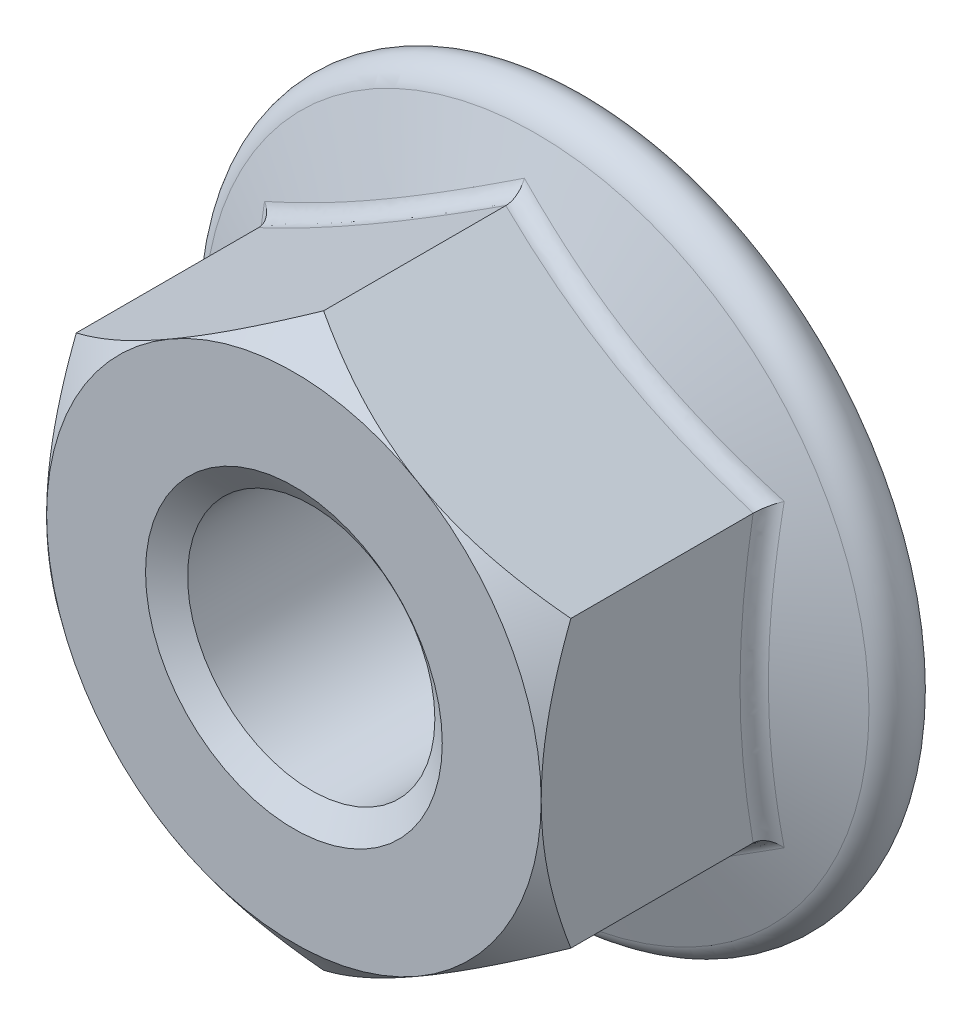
SolidWorks part; units mm, degrees
ref_plane "Plane1" through (0, 0, 0) normal (0, 0, 1) x (1, 0, 0)
ref_plane "Plane2" through (0, 0, 0) normal (0, 1, 0) x (1, 0, 0)
ref_plane "Plane3" through (0, 0, 0) normal (1, 0, 0) x (0, 0, -1)
revolve "EndChamfer" cut sketch "Sketch5"
sketch "Sketch5"
  line L0 (5.9746, 3) -> (5.5895, 2.45)
  line L1 (6.0254, 3) -> (5.9746, 3)
  line L2 (6.0254, 3) -> (6.0254, 2.45)
  line L3 (6.0254, 2.45) -> (5.5895, 2.45)
  line L6 (-0.0508, 3) -> (0, 3)
  line L7 (0, 3) -> (0.3851, 2.45)
  line L9 (0.3851, 2.45) -> (-0.0508, 2.45)
  line L10 (-0.0508, 2.45) -> (-0.0508, 3)
  line L11 (25.0375, 0) -> (38.388, 0) construction
  line L12 (6, 0) -> (0, 0) construction
extrude "BaseNut" add sketch "BaseNutSke" against normal blind 6
sketch "BaseNutSke" plane through (0, 0, 0) normal (0, 0, 1) x (1, 0, 0)
  line L6 (5, 2.8868) -> (5, -2.8868)
  line L7 (-5, 2.8868) -> (-5, -2.8868)
  line L8 (5, 2.8868) -> (0, 5.7735)
  line L9 (0, 5.7735) -> (-5, 2.8868)
  line L10 (-5, -2.8868) -> (0, -5.7735)
  line L11 (0, -5.7735) -> (5, -2.8868)
  circle A0 centre (0, 0) radius 2.5
  dimension "D4" = 5
  dimension "Tap_drill" = 5
  dimension "D1" = 120
  dimension "D2" = 5
  dimension "D3" = 5
  dimension "Width_flats" = 10
pattern_linear "ThdSchPat"
revolve "ThreadSchematic" cut sketch "ThdSchSke" angle 360 about L11
sketch "ThdSchSke" plane through (0, 0, 0) normal (0, 1, 0) x (1, 0, 0)
  line L0 (-3, 0.0254) -> (-2.5, 0.3755)
  line L1 (-2.5, 0.3755) -> (-1.25, 0.3755)
  line L2 (-1.25, 0.3755) -> (-1.25, -0.3247)
  line L3 (-1.25, -0.3247) -> (-2.5, -0.3247)
  line L4 (-2.5, -0.3247) -> (-3, 0.0254)
  line L5 (-3.175, 1) -> (3.175, 1) construction
  line L6 (0, 1) -> (0, -2.9874) construction
  line L7 (0, 5.6245) -> (0, 0.3501) construction
  dimension "D1" = 35
  dimension "VeeAngle" = 70
  dimension "SideAngle" = 55
  dimension "D2" = 0.0508
  dimension "OverCut" = 2.5
  dimension "Tap_Drill" = 5
  dimension "Advance" = 0.9915
  dimension "Thread_major" = 6
  dimension "Num_threads" = 7
  dimension "D4" = 50
  dimension "Offset1" = 6.0254
  dimension "ThreadMajor" = 3
  dimension "ChamferDepth" = 0.55
  dimension "Offset2" = 6.0762
sketch "Sketch6" plane through (0, 0, 0) normal (1, 0, 0) x (0, 0, -1)
  line L0 (3.3615, 2.5) -> (4.9, 6.7269)
  line L1 (6, 2.5) -> (6, 6.5329)
  line L2 (4.9, 32.2909) -> (4.9, 6.7269) construction
  line L3 (23.7075, 7.1) -> (19.5103, 7.1) construction
  line L4 (6, 2.5) -> (3.3615, 2.5)
  line L5 (23.7075, -7.1) -> (19.5103, -7.1) construction
  line L6 (6, 2.8868) -> (6, 5.7735) construction
  line L7 (0, 0) -> (32.9582, 0) construction
  line L8 (6, -2.5) -> (3.3615, -2.5) construction
  line L9 (6, 0) -> (0, 0) construction
  arc A0 (6, 6.5329) -> (4.9, 6.7269) centre (5.4329, 6.5329) ccw
  dimension "D1" = 5
  dimension "D2" = 20
  dimension "Flange_dia" = 14.2
  dimension "Flange_thickness" = 1.1
revolve "Flange" add sketch "Sketch6" angle 360 about L7
sketch "Sketch3" plane through (0, 0, 0) normal (1, 0, 0) x (0, 0, -1)
  line L0 (6, 5) -> (5.4, 5.7735) construction
  line L1 (5.4, 5.7735) -> (5.4, 18.4735) construction
  line L2 (5.4, 18.4735) -> (18.7, 18.4735) construction
  line L3 (18.7, 18.4735) -> (18.7, 5) construction
  line L4 (18.7, 5) -> (6, 5) construction
  line L5 (6, 2.8868) -> (6, 5.7735) construction
  line L6 (4.553, 5.7735) -> (0, 5.7735) construction
  line L7 (0, 0) -> (38.6776, 0) construction
  line L8 (6, 0) -> (0, 0) construction
  line L9 (3, 5.7735) -> (3, 44.222) construction
  line L10 (0.6, 18.4735) -> (-12.7, 18.4735)
  line L11 (-12.7, 18.4735) -> (-12.7, 5)
  line L12 (-12.7, 5) -> (0, 5)
  line L13 (0, 5) -> (0.6, 5.7735)
  line L14 (0.6, 5.7735) -> (0.6, 18.4735)
  line L16 (4.553, 5.7735) -> (0, 5.7735) construction
  dimension "D1" = 5
  dimension "D2" = 0.6
  dimension "D3" = 12.7
  dimension "D4" = 12.7
  dimension "D5" = 3
revolve "Double-Chamfer" cut sketch "Sketch3" angle 360 about L7
fillet "FlangeFillet" radius 0.36 6 edges
equation "\"D2@BaseNutSke\" = \"Width_flats@BaseNutSke\" / 2"
equation "\"D3@BaseNutSke\" = \"Width_flats@BaseNutSke\" / 2"
equation "\"D1@Sketch3\" = \"Width_flats@BaseNutSke\" /2"
equation "\"D2@Sketch3\" = \"Thread_major@ThreadCosmetic\" *.1"
equation "\"D4@BaseNutSke\" = \"D3@BaseNutSke\""
equation "\"Thread_major@ThdSchSke\" = \"Thread_major@ThreadCosmetic\""
equation "\"Tap_drill@ThdSchSke\" = \"Tap_drill@BaseNutSke\""
equation "\"Overcut@ThdSchSke\" = \"Tap_drill@ThdSchSke\" * 0.5"
equation "\"Num_threads@ThdSchPat\" = int(  ( \"Thickness@BaseNut\" - 0.0508 ) / \"Advance@ThdSchSke\" + 0.999 )  + 1"
equation "\"Advance@ThdSchPat\" = ( \"Thickness@BaseNut\" - 0.0508 ) /  (\"Num_threads@ThdSchPat\" - 1) 'relax it"
equation "' \"Num_threads@ThdSchPat\" = \"Num_threads@ThdSchPat\" - sgn( \"Num_threads@ThdSchPat\" - 1) '---chamfered tips only---"
equation "\"ThreadMajor@Sketch5\" = \"Thread_major@ThreadCosmetic\" * 0.5"
equation "\"ChamferDepth@Sketch5\" = (\"Thread_major@ThreadCosmetic\" - \"Tap_drill@BaseNutSke\") * 0.55"
equation "\"Offset1@Sketch5\" = \"Thickness@BaseNut\" + 0.0254"
equation "\"Offset2@Sketch5\" = \"Offset1@Sketch5\" + 0.0508"
equation "\"D1@Sketch6\" = \"Tap_drill@BaseNutSke\""
equation "\"D5@Sketch3\" = \"Thickness@BaseNut\" / 2"
